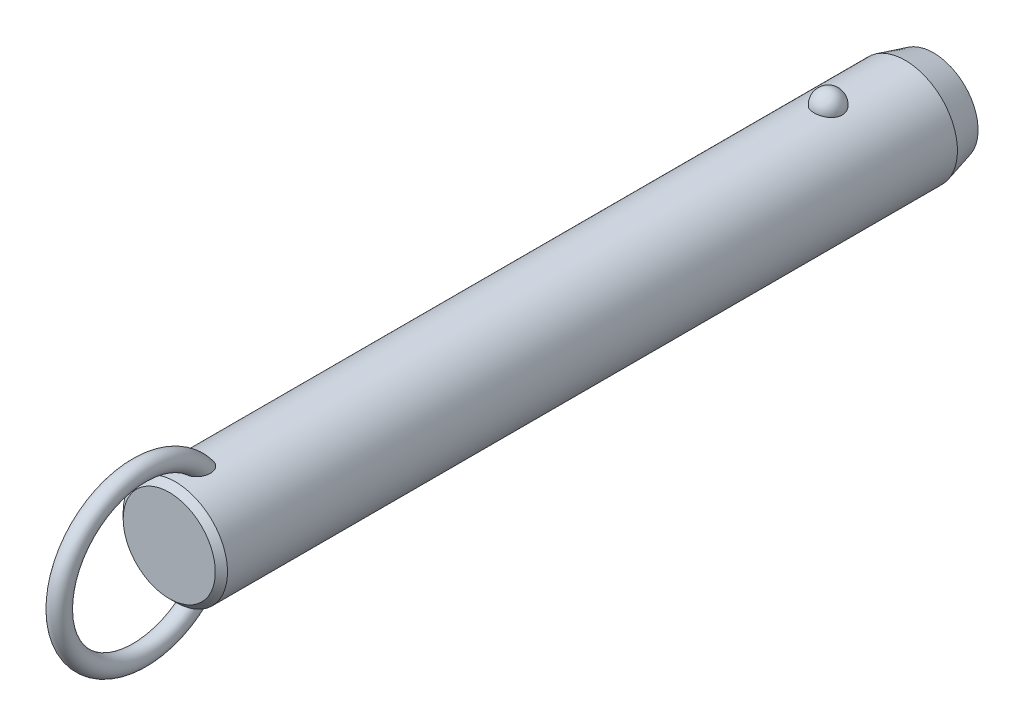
SolidWorks part; units mm, degrees
ref_plane "Front Plane" through (0, 0, 0) normal (0, 0, 1) x (1, 0, 0)
ref_plane "Top Plane" through (0, 0, 0) normal (0, 1, 0) x (1, 0, 0)
ref_plane "Right Plane" through (0, 0, 0) normal (1, 0, 0) x (0, 0, -1)
sketch "Sketch2" plane through (0, 0, 0) normal (0, 0, 1) x (1, 0, 0)
  circle A0 centre (0, 0) radius 11.1
  point P3 (0, 11.1)
  dimension "D1" = 22.2
extrude "Boss-Extrude1" add sketch "Sketch2" along normal blind 124.5
sketch "Sketch3" plane through (0, 0, 0) normal (0, 0, -1) x (-1, 0, 0)
  circle A0 centre (0, 0) radius 11.1
  dimension "D1" = 22.2
extrude "Boss-Extrude2" add sketch "Sketch3" along normal blind 25.4
chamfer "Chamfer1" distance 6 angle 15 1 edges at (-11.1, 0, -25.4)
sketch "Sketch12" plane through (0, 0, 0) normal (1, 0, 0) x (0, 0, -1)
  line L0 (-124.5, 11.1) -> (-124.5, -11.1) construction
  point P0 (-124.5, 0)
sketch "Sketch13" plane through (0, 0, 0) normal (1, 0, 0) x (0, 0, -1)
  circle A0 centre (-143.55, 0) radius 19.05
  point P2 (-124.5, 0)
  dimension "D1" = 38.1
sketch "Sketch14" plane through (0, 0, 0) normal (0, 1, 0) x (1, 0, 0)
  circle A0 centre (0, -126.5) radius 2
  point P2 (0, -124.5)
  dimension "D1" = 4
sweep "Sweep1" add profiles "Sketch14" path "Sketch13"
sketch "Sketch15" plane through (0, 0, 124.5) normal (0, 0, 1) x (1, 0, 0)
  circle A0 centre (0, 0) radius 11.1
  dimension "D1" = 22.2
extrude "Boss-Extrude3" add sketch "Sketch15" along normal blind 12.7
chamfer "Chamfer2" distance 1.3 angle 45 1 edges at (11.1, 0, 137.2)
sketch "Sketch18" plane through (0, 0, 0) normal (1, 0, 0) x (0, 0, -1)
  line L0 (19.4, 11.1) -> (-128.068, 11.1) construction
  line L1 (3, 14.1) -> (3, 8.1)
  line L2 (-128.068, -11.1) -> (19.4, -11.1) construction
  arc A0 (3, 14.1) -> (3, 8.1) centre (3, 11.1) ccw
  point P4 (0, 11.1)
  dimension "D1" = 25.2
revolve "Revolve1" add sketch "Sketch18" angle 360 about L1
